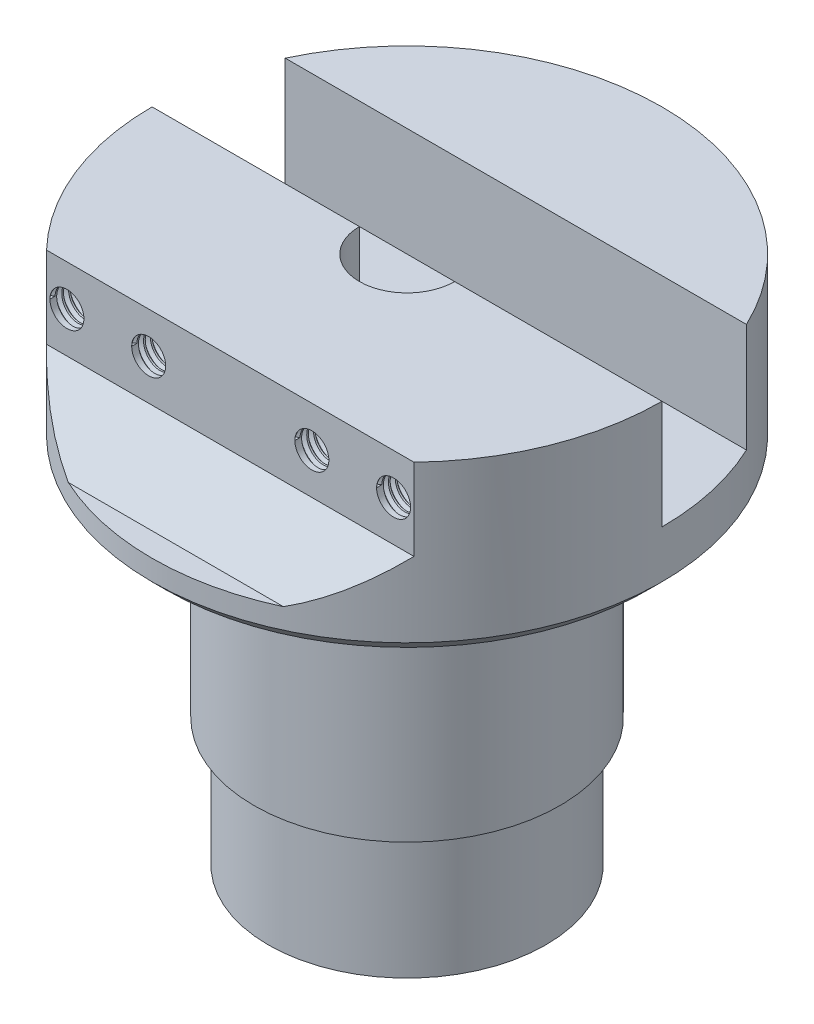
SolidWorks part; units mm, degrees
other "Arbor"
ref_plane "Front Plane" through (0, 0, 0) normal (0, 0, 1) x (1, 0, 0)
ref_plane "Top Plane" through (0, 0, 0) normal (0, 1, 0) x (1, 0, 0)
ref_plane "Right Plane" through (0, 0, 0) normal (1, 0, 0) x (0, 0, -1)
sketch "Sketch1" plane through (0, 0, 0) normal (0, 1, 0) x (1, 0, 0)
  circle A0 centre (0, 0) radius 20.4
  dimension "D1" = 40.8
extrude "Boss-Extrude1" add sketch "Sketch1" against normal blind 18.8
sketch "Sketch2" plane through (0, 0, 0) normal (0, 1, 0) x (1, 0, 0)
  circle A0 centre (0, 0) radius 10.97
  dimension "D1" = 21.94
extrude "Boss-Extrude2" add sketch "Sketch2" along normal blind 18
sketch "Sketch15" plane through (0, 18, 0) normal (0, 1, 0) x (1, 0, 0)
  circle A0 centre (0, 0) radius 4
  dimension "D1" = 8
extrude "Cut-Extrude2" cut sketch "Sketch15" against normal through all
thread "Thread1" pitch 1.5 start angle 0, offset 0, length 0, pitch 1.5, diameter 8
ref_plane "Plane1" through (-4, 18, 0) normal (0, 0, 1) x (-1, 0, 0)
sketch "Thread Profile1" plane through (-4, 18, 0) normal (0, 0, 1) x (-1, 0, 0)
  line L0 (0, 0) -> (0, 1.5) construction
  line L1 (0, 0) -> (0.8119, 0.4687)
  line L2 (0.8119, 0.4687) -> (0.8119, 0.6562)
  line L3 (0.8119, 0.6562) -> (0, 1.125)
  line L4 (0.8119, 0.5625) -> (0, 0.5625) construction
  line L11 (0, 0) -> (0, 1.125)
  point P2 (0, 0)
  dimension "Pitch" = 1.5
  dimension "Profile_Angle" = 60
  dimension "Profile_Land" = 0.1875
  dimension "Profile_Height" = 0.8119
sketch "Sketch22" plane through (0, 0, 0) normal (0, 1, 0) x (1, 0, 0)
  circle A0 centre (0, 0) radius 10.97 construction
  circle A1 centre (0, 0) radius 10.97
  circle A2 centre (0, 0) radius 22.5
  dimension "D1" = 45
extrude "Boss-Extrude3" add sketch "Sketch22" along normal up to surface (18 mm away) separate body
sketch "Sketch23" plane through (0, 18, 0) normal (0, 1, 0) x (1, 0, 0)
  circle A0 centre (0, 0) radius 22.5 construction
  circle A1 centre (0, 0) radius 22.5
extrude "Boss-Extrude4" add sketch "Sketch23" along normal blind 16
sketch "Sketch24" plane through (0, 34, 0) normal (0, 1, 0) x (1, 0, 0)
  circle A0 centre (0, 0) radius 4
  dimension "D1" = 8
extrude "Cut-Extrude3" cut sketch "Sketch24" against normal up to next
sketch "Sketch25" plane through (0, 34, 0) normal (0, 1, 0) x (1, 0, 0)
  circle A0 centre (0, 0) radius 7
  dimension "D1" = 14
extrude "Cut-Extrude4" cut sketch "Sketch25" against normal blind 12
sketch "Sketch26" plane through (0, 34, 0) normal (0, 1, 0) x (1, 0, 0)
  circle A0 centre (0, 0) radius 37.5
  circle A1 centre (0, 0) radius 7 construction
  circle A2 centre (0, 0) radius 7
  dimension "D1" = 75
extrude "Boss-Extrude6" add sketch "Sketch26" along normal blind 25
fillet "Fillet1" radius 8 1 edges at (0, 34, 22.5)
chamfer "Chamfer1" distance 2 angle 45 1 edges at (0, 34, 37.5)
sketch "Sketch27" plane through (0, 59, 0) normal (0, 1, 0) x (1, 0, 0)
  line L0 (0, 0) -> (37.5, 0)
  line L1 (37.5, 0) -> (37.5, 16)
  line L2 (37.5, 16) -> (-37.5, 16)
  line L3 (-37.5, 16) -> (-37.5, 0)
  line L4 (-37.5, 0) -> (0, 0)
  circle A0 centre (0, 0) radius 37.5 construction
  dimension "D1" = 16
extrude "Cut-Extrude5" cut sketch "Sketch27" against normal blind 16
ref_plane "Plane2" through (0, 0, 26) normal (0, 0, 1) x (1, 0, 0)
sketch "Sketch28" plane through (0, 0, 26) normal (0, 0, 1) x (1, 0, 0)
  line L0 (37.5, 59) -> (-37.5, 59) construction
  line L1 (37.5, 59) -> (-37.5, 59)
  line L2 (37.5, 59) -> (37.5, 39)
  line L3 (37.5, 39) -> (-37.5, 39)
  line L4 (-37.5, 39) -> (-37.5, 59)
  dimension "D1" = 20
extrude "Cut-Extrude6" cut sketch "Sketch28" along normal through all
chamfer "Chamfer2" distance 8 angle 45 1 edges at (0, 39, 26)
sketch "Sketch29" plane through (0, 0, 26) normal (0, 0, 1) x (1, 0, 0)
  line L0 (27.0231, 53) -> (24.0231, 53) construction
  line L3 (0, 53) -> (0, 59) construction
  line L4 (27.0231, 59) -> (-27.0231, 59) construction
  line L5 (27.0231, 59) -> (27.0231, 47) construction
  line L6 (24.0231, 53) -> (12, 53) construction
  line L7 (12, 53) -> (0, 53) construction
  line L8 (0, 53) -> (-12, 53) construction
  line L9 (-12, 53) -> (-24.0231, 53) construction
  line L10 (-24.0231, 53) -> (-27.0231, 53) construction
  line L11 (-27.0231, 47) -> (-27.0231, 59) construction
  circle A0 centre (24.0231, 53) radius 2.5
  circle A1 centre (12, 53) radius 2.5
  circle A2 centre (-12, 53) radius 2.5
  circle A3 centre (-24.0231, 53) radius 2.5
  dimension "D2" = 5
  dimension "D1" = 12
  dimension "D3" = 3
extrude "Cut-Extrude7" cut sketch "Sketch29" against normal up to next
thread "Thread2" pitch 1 start angle 0, offset 0, length 0, pitch 1, diameter 5
ref_plane "Plane3" through (-26.5231, 53, 26) normal (0, -1, 0) x (-1, 0, 0)
sketch "Thread Profile2" plane through (-26.5231, 53, 26) normal (0, -1, 0) x (-1, 0, 0)
  line L0 (0, 0) -> (0, 1) construction
  line L1 (0, 0) -> (0.5413, 0.3125)
  line L2 (0.5413, 0.3125) -> (0.5413, 0.4375)
  line L3 (0.5413, 0.4375) -> (0, 0.75)
  line L4 (0.5413, 0.375) -> (0, 0.375) construction
  line L11 (0, 0) -> (0, 0.75)
  point P2 (0, 0)
  dimension "Pitch" = 1
  dimension "Profile_Angle" = 60
  dimension "Profile_Land" = 0.125
  dimension "Profile_Height" = 0.5413
thread "Thread3" pitch 1 start angle 0, offset 0, length 0, pitch 1, diameter 5
ref_plane "Plane4" through (-14.5, 53, 26) normal (0, -1, 0) x (-1, 0, 0)
sketch "Thread Profile3" plane through (-14.5, 53, 26) normal (0, -1, 0) x (-1, 0, 0)
  line L0 (0, 0) -> (0, 1) construction
  line L1 (0, 0) -> (0.5413, 0.3125)
  line L2 (0.5413, 0.3125) -> (0.5413, 0.4375)
  line L3 (0.5413, 0.4375) -> (0, 0.75)
  line L4 (0.5413, 0.375) -> (0, 0.375) construction
  line L11 (0, 0) -> (0, 0.75)
  point P2 (0, 0)
  dimension "Pitch" = 1
  dimension "Profile_Angle" = 60
  dimension "Profile_Land" = 0.125
  dimension "Profile_Height" = 0.5413
thread "Thread4" pitch 1 start angle 0, offset 0, length 0, pitch 1, diameter 5
ref_plane "Plane5" through (9.5, 53, 26) normal (0, -1, 0) x (-1, 0, 0)
sketch "Thread Profile4" plane through (9.5, 53, 26) normal (0, -1, 0) x (-1, 0, 0)
  line L0 (0, 0) -> (0, 1) construction
  line L1 (0, 0) -> (0.5413, 0.3125)
  line L2 (0.5413, 0.3125) -> (0.5413, 0.4375)
  line L3 (0.5413, 0.4375) -> (0, 0.75)
  line L4 (0.5413, 0.375) -> (0, 0.375) construction
  line L11 (0, 0) -> (0, 0.75)
  point P2 (0, 0)
  dimension "Pitch" = 1
  dimension "Profile_Angle" = 60
  dimension "Profile_Land" = 0.125
  dimension "Profile_Height" = 0.5413
thread "Thread5" pitch 1 start angle 0, offset 0, length 0, pitch 1, diameter 5
ref_plane "Plane6" through (21.5231, 53, 26) normal (0, -1, 0) x (-1, 0, 0)
sketch "Thread Profile5" plane through (21.5231, 53, 26) normal (0, -1, 0) x (-1, 0, 0)
  line L0 (0, 0) -> (0, 1) construction
  line L1 (0, 0) -> (0.5413, 0.3125)
  line L2 (0.5413, 0.3125) -> (0.5413, 0.4375)
  line L3 (0.5413, 0.4375) -> (0, 0.75)
  line L4 (0.5413, 0.375) -> (0, 0.375) construction
  line L11 (0, 0) -> (0, 0.75)
  point P2 (0, 0)
  dimension "Pitch" = 1
  dimension "Profile_Angle" = 60
  dimension "Profile_Land" = 0.125
  dimension "Profile_Height" = 0.5413
